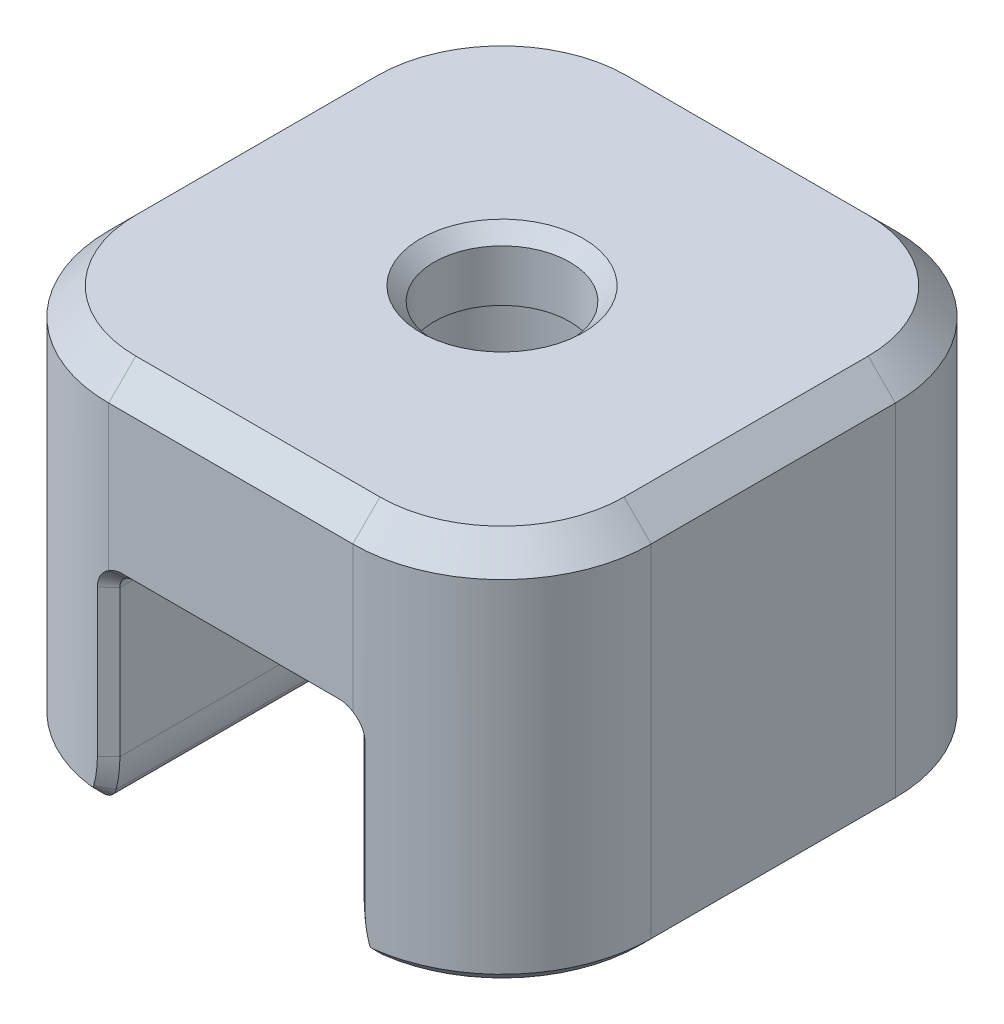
SolidWorks part; units mm, degrees
ref_plane "Front Plane" through (0, 0, 0) normal (0, 0, 1) x (1, 0, 0)
ref_plane "Top Plane" through (0, 0, 0) normal (0, 1, 0) x (1, 0, 0)
ref_plane "Right Plane" through (0, 0, 0) normal (1, 0, 0) x (0, 0, -1)
sketch "Sketch1" plane through (0, 0, 0) normal (0, 1, 0) x (1, 0, 0)
  line L0 (0, 10) -> (0, -10) construction
  line L1 (-4.4, 10) -> (4.5, 10)
  line L2 (-10, 4.4) -> (-10, -4.5)
  line L3 (-4.5, -10) -> (4.5, -10)
  line L4 (10, 4.5) -> (10, -4.5)
  line L5 (-10, 0) -> (10, 0) construction
  arc A0 (-10, 4.4) -> (-4.4, 10) centre (-4.4, 4.4) cw
  arc A1 (-10, -4.5) -> (-4.5, -10) centre (-4.5, -4.5) ccw
  arc A2 (4.5, -10) -> (10, -4.5) centre (4.5, -4.5) ccw
  arc A3 (10, 4.5) -> (4.5, 10) centre (4.5, 4.5) ccw
  dimension "D1" = 5.6
  dimension "D4" = 5.5
  dimension "D2" = 20
  dimension "D3" = 20
extrude "Boss-Extrude1" add sketch "Sketch1" along normal blind 14
sketch "Sketch2" plane through (0, 0, 10) normal (0, 0, 1) x (1, 0, 0)
  line L0 (-10, 0) -> (-4.5, 0) construction
  line L2 (-4.5, 1.5) -> (-4.5, 6.9)
  line L3 (-4, 7.4) -> (4, 7.4)
  line L4 (4.5, 1.5) -> (4.5, 6.9)
  line L7 (5.1377, 0) -> (6, 0)
  line L8 (6, 0) -> (6, -2.4037)
  line L9 (0, 0) -> (0, 14) construction
  line L10 (-4.5, 14) -> (4.5, 14) construction
  line L11 (-6, 0) -> (-6, -2.4037)
  line L12 (-5.1377, 0) -> (-6, 0)
  line L13 (-6, -2.4037) -> (6, -2.4037)
  line L15 (4.5, 0) -> (10, 0) construction
  arc A0 (-4.5, 6.9) -> (-4, 7.4) centre (-4, 6.9) cw
  arc A1 (4.5, 6.9) -> (4, 7.4) centre (4, 6.9) ccw
  arc A2 (4.5, 1.5) -> (4.6563, 0.3649) centre (8.7, 1.5) ccw
  arc A3 (4.6563, 0.3649) -> (5.1377, 0) centre (5.1377, 0.5) ccw
  arc A4 (-4.6563, 0.3649) -> (-5.1377, 0) centre (-5.1377, 0.5) cw
  arc A5 (-4.5, 1.5) -> (-4.6563, 0.3649) centre (-8.7, 1.5) cw
  point P9 (-4.5, 7.4)
  point P12 (4.5, 7.4)
  dimension "D3" = 0.5
  dimension "D6" = 4.2
  dimension "D7" = 0.5
  dimension "D1" = 9
  dimension "D2" = 12
  dimension "D4" = 7.4
  dimension "D5" = 1.5
extrude "Cut-Extrude1" cut sketch "Sketch2" against normal through all
hole_wizard "CBORE for M4 SHCS1" positions "Sketch3" profile "Sketch4" counterbore size "M4" standard "ANSI Metric"
sketch "Sketch3" plane through (0, 7.4, 0) normal (0, -1, 0) x (-1, 0, 0)
  point P0 (0, 0)
sketch "Sketch4" plane through (0, 7.4, 0) normal (1, 0, 0) x (0, 0, -1)
  line L0 (0, 0) -> (0, 6.6)
  line L1 (0, 6.6) -> (2.5, 6.6)
  line L3 (2.5, 6.6) -> (2.5, 4.2)
  line L4 (2.5, 4.2) -> (3.6, 4.2)
  line L5 (3.6, 4.2) -> (3.6, 0)
  line L7 (3.6, 0) -> (0, 0)
  line L11 (0, -6.35) -> (0, 107.95) construction
  dimension "Thru Hole Dia." = 5
  dimension "Thru Hole Depth" = 6.6
  dimension "C'Bore Dia." = 7.2
  dimension "C'Bore Depth" = 4.2
hole_wizard "M6x1.0 Tapped Hole1" positions "Sketch5" profile "Sketch6" tap size "M6x1.0" standard "ANSI Metric"
sketch "Sketch5" plane through (0, 11.6, 0) normal (0, -1, 0) x (-1, 0, 0)
  point P0 (0, 0)
sketch "Sketch6" plane through (0, 11.6, 0) normal (1, 0, 0) x (0, 0, -1)
  line L0 (0, 0) -> (0, 2.4)
  line L1 (0, 2.4) -> (2.5005, 2.4)
  line L2 (2.5005, 2.4) -> (2.5005, 0)
  line L5 (2.5005, 0) -> (0, 0)
  line L11 (0, -6.35) -> (0, 107.95) construction
  dimension "Thru Tap Drill Dia." = 5.001
  dimension "Thru Tap Drill Depth" = 2.4
chamfer "Chamfer1" distance 1 angle 45 8 edges at (8.3891, 14, -8.3891) (10, 14, 0) (8.3891, 14, 8.3891) (0, 14, 10) (-8.3891, 14, 8.3891) (-10, 14, 0.05) (-8.3598, 14, -8.3598) (0.05, 14, -10)
chamfer "Chamfer2" distance 0.5 angle 45 1 edges at (0, 14, -2.5005)
chamfer "Chamfer3" distance 0.1 angle 45 1 edges at (0, 7.4, -3.6)
chamfer "Chamfer4" distance 0.4 angle 45 25 edges at (-10, 0, 0.05) (10, 0, 0) (-8.6084, 0, 8.1567) (-8.6125, 0, -8.0898) (-4.8255, 0.1094, 9.9904) (-4.8456, 0.0942, -9.9822) (-4.3536, 7.2536, 10) (-4.2236, 7.3472, -10) (0, 7.4, 10) (0, 7.4, -10) (4.3536, 7.2536, 10) (4.3536, 7.2536, -10) (4.8458, 0.0941, 9.9891) (4.8255, 0.1094, -9.9904) (8.6084, 0, 8.1567) (8.6084, 0, -8.1567) (-4.5, 4.2, 10) (-4.5, 4.2, -9.9991) (4.5, 4.2, 10) (4.5, 4.2, -10) (-4.4768, 7.0507, -9.9995)
sketch "Sketch7" plane through (0, 14, 0) normal (0, 1, 0) x (1, 0, 0)
  line L0 (-10, 5) -> (-10, -5)
  line L1 (-5, -10) -> (5, -10)
  line L2 (10, -5) -> (10, 5)
  line L3 (5, 10) -> (-5, 10)
  line L4 (-4.4, 10) -> (4.5, 10) construction
  line L5 (4.5, -10) -> (-4.5, -10) construction
  line L6 (10, 4.5) -> (10, -4.5) construction
  line L7 (-10, -4.5) -> (-10, 4.4) construction
  arc A0 (5, 10) -> (10, 5) centre (5, 5) cw
  arc A1 (10, -5) -> (5, -10) centre (5, -5) cw
  arc A2 (-5, -10) -> (-10, -5) centre (-5, -5) cw
  arc A3 (-10, 5) -> (-5, 10) centre (-5, 5) cw
  dimension "D1" = 5
